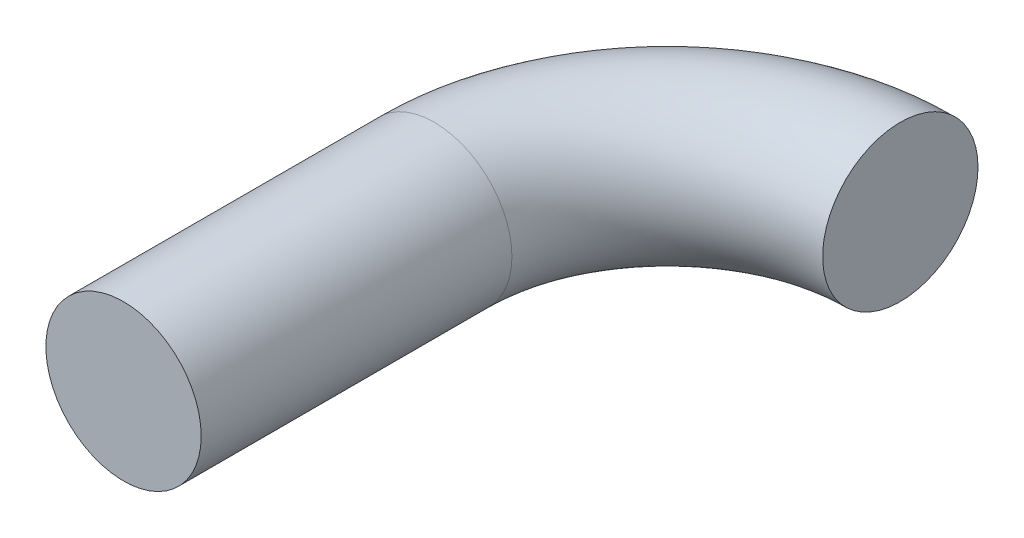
SolidWorks part; units mm, degrees
ref_plane "Front Plane" through (0, 0, 0) normal (0, 0, 1) x (1, 0, 0)
ref_plane "Top Plane" through (0, 0, 0) normal (0, 1, 0) x (1, 0, 0)
ref_plane "Right Plane" through (0, 0, 0) normal (1, 0, 0) x (0, 0, -1)
sketch "Sketch1" plane through (0, 0, 0) normal (0, 0, 1) x (1, 0, 0)
  circle A0 centre (0, 0) radius 25.4
  dimension "D1" = 50.8
sketch "Sketch2" plane through (0, 0, 0) normal (0, 1, 0) x (1, 0, 0)
  line L0 (0, 0) -> (0, 101.6)
  arc A0 (0, 101.6) -> (76.2, 177.8) centre (76.2, 101.6) cw
  dimension "D1" = 76.2
  dimension "D2" = 101.6
  dimension "D3" = 90
sweep "Sweep1" add profiles "Sketch1" path "Sketch2"
